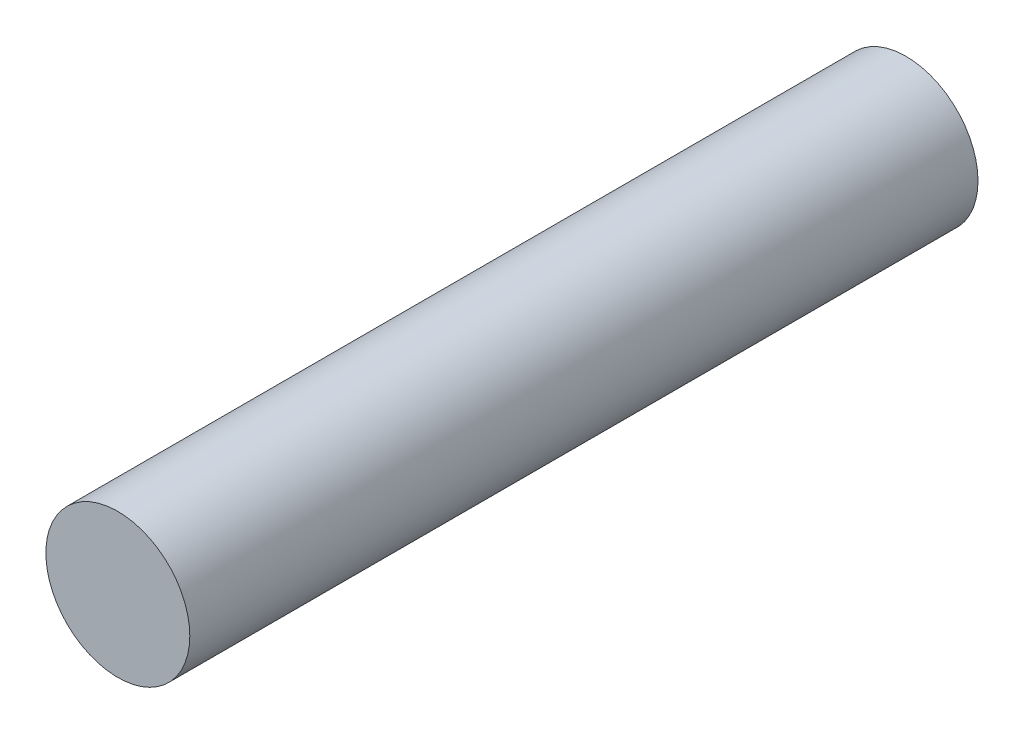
SolidWorks part; units mm, degrees
ref_plane "Front Plane" through (0, 0, 0) normal (0, 0, 1) x (1, 0, 0)
ref_plane "Top Plane" through (0, 0, 0) normal (0, 1, 0) x (1, 0, 0)
ref_plane "Right Plane" through (0, 0, 0) normal (1, 0, 0) x (0, 0, -1)
sketch "Sketch1" plane through (0, 0, 0) normal (0, 0, 1) x (1, 0, 0)
  circle A0 centre (0, 0) radius 13.335
  dimension "D1" = 26.67
extrude "Boss-Extrude1" add sketch "Sketch1" along normal blind 146.05
